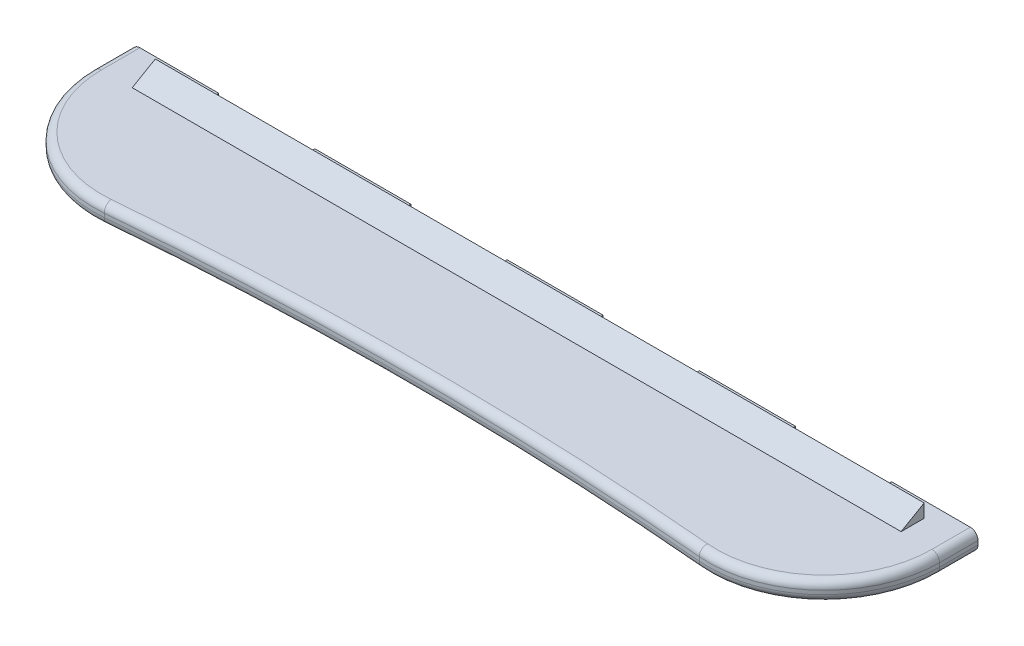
SolidWorks part; units mm, degrees
ref_plane "Спереди" through (0, 0, 0) normal (0, 0, 1) x (1, 0, 0)
ref_plane "Сверху" through (0, 0, 0) normal (0, 1, 0) x (1, 0, 0)
ref_plane "Справа" through (0, 0, 0) normal (1, 0, 0) x (0, 0, -1)
sketch "Эскиз1" plane through (0, 0, 0) normal (0, 1, 0) x (1, 0, 0)
  line L0 (-110, 16) -> (110, 16) construction
  line L1 (-110, 20) -> (110, 20) construction
  line L2 (-110, 20) -> (-110, -20) construction
  line L3 (-110, -20) -> (110, -20) construction
  line L4 (110, 20) -> (110, -20) construction
  line L5 (-110, 20) -> (110, -20) construction
  line L6 (-110, -20) -> (110, 20) construction
  line L7 (-110, 10) -> (-80, 10) construction
  line L8 (-110, 10) -> (-110, 20)
  line L9 (-80, 10) -> (-77.3853, -19.8858) construction
  line L10 (110, 10) -> (80, 10) construction
  line L11 (110, 10) -> (110, 20)
  line L12 (80, 10) -> (77.3853, -19.8858) construction
  line L13 (110, 20) -> (87.5, 20)
  line L14 (87.5, 20) -> (87.5, 16)
  line L15 (87.5, 16) -> (62.5, 16)
  line L16 (62.5, 16) -> (62.5, 20)
  line L17 (62.5, 20) -> (37.5, 20)
  line L18 (37.5, 20) -> (37.5, 16)
  line L19 (37.5, 16) -> (12.5, 16)
  line L20 (12.5, 16) -> (12.5, 20)
  line L21 (12.5, 20) -> (-12.5, 20)
  line L22 (-12.5, 20) -> (-12.5, 16)
  line L23 (-12.5, 16) -> (-37.5, 16)
  line L24 (-37.5, 16) -> (-37.5, 20)
  line L25 (-37.5, 20) -> (-62.5, 20)
  line L26 (-62.5, 20) -> (-62.5, 16)
  line L27 (-62.5, 16) -> (-87.5, 16)
  line L28 (-87.5, 16) -> (-87.5, 20)
  line L29 (-87.5, 20) -> (-110, 20)
  arc A1 (-110, 10) -> (-77.3853, -19.8858) centre (-80, 10) ccw
  arc A2 (77.3853, -19.8858) -> (110, 10) centre (80, 10) ccw
  arc A3 (-77.3853, -19.8858) -> (77.3853, -19.8858) centre (0, -904.4042) cw
  point P0 (0, 0)
  dimension "D1" = 220
  dimension "D2" = 4
  dimension "D3" = 40
  dimension "D4" = 30
  dimension "D5" = 30
  dimension "D6" = 30
  dimension "D7" = 30
  dimension "D8" = 25
  dimension "D9" = 25
  dimension "D10" = 25
  dimension "D11" = 25
  dimension "D12" = 12.5
  dimension "D13" = 25
  dimension "D14" = 25
  dimension "D15" = 25
  dimension "D16" = 95
  dimension "D17" = 85
extrude "Бобышка-Вытянуть1" add sketch "Эскиз1" along normal blind 5
sketch "Эскиз2" plane through (110, 0, 0) normal (1, 0, 0) x (0, 0, -1)
  line L0 (10, 5) -> (16, 8.4641)
  line L1 (16, 8.4641) -> (16, 5)
  line L2 (10, 5) -> (20, 5) construction
  line L3 (16, 5) -> (10, 5)
  dimension "D1" = 6
  dimension "D2" = 30
extrude "Бобышка-Вытянуть2" add sketch "Эскиз2" against normal blind 200 from offset 10
sketch "Эскиз3" plane through (0, 0, 0) normal (0, -1, 0) x (1, 0, 0)
  line L0 (73, 13.75) -> (67, 13.75)
  line L1 (90, 12) -> (-90, 12) construction
  line L3 (93, 10.25) -> (87, 10.25)
  line L5 (93, 13.75) -> (87, 13.75)
  line L6 (87, 10.25) -> (87, 13.75) construction
  line L7 (93, 10.25) -> (87, 13.75) construction
  line L8 (93, 13.75) -> (87, 10.25) construction
  line L44 (73, 10.25) -> (67, 10.25)
  line L45 (53, 13.75) -> (47, 13.75)
  line L46 (53, 10.25) -> (47, 10.25)
  line L47 (33, 13.75) -> (27, 13.75)
  line L48 (33, 10.25) -> (27, 10.25)
  line L49 (13, 13.75) -> (7, 13.75)
  line L50 (13, 10.25) -> (7, 10.25)
  line L51 (-7, 13.75) -> (-13, 13.75)
  line L52 (-7, 10.25) -> (-13, 10.25)
  line L53 (-27, 13.75) -> (-33, 13.75)
  line L54 (-27, 10.25) -> (-33, 10.25)
  line L55 (-47, 13.75) -> (-53, 13.75)
  line L56 (-47, 10.25) -> (-53, 10.25)
  line L57 (-67, 13.75) -> (-73, 13.75)
  line L58 (-67, 10.25) -> (-73, 10.25)
  line L59 (-87, 13.75) -> (-93, 13.75)
  line L60 (-87, 10.25) -> (-93, 10.25)
  arc A0 (93, 10.25) -> (93, 13.75) centre (93, 12) ccw
  arc A1 (87, 13.75) -> (87, 10.25) centre (87, 12) ccw
  arc A2 (73, 10.25) -> (73, 13.75) centre (73, 12) ccw
  arc A3 (67, 13.75) -> (67, 10.25) centre (67, 12) ccw
  arc A4 (53, 10.25) -> (53, 13.75) centre (53, 12) ccw
  arc A5 (47, 13.75) -> (47, 10.25) centre (47, 12) ccw
  arc A6 (33, 10.25) -> (33, 13.75) centre (33, 12) ccw
  arc A7 (27, 13.75) -> (27, 10.25) centre (27, 12) ccw
  arc A8 (13, 10.25) -> (13, 13.75) centre (13, 12) ccw
  arc A9 (7, 13.75) -> (7, 10.25) centre (7, 12) ccw
  arc A10 (-7, 10.25) -> (-7, 13.75) centre (-7, 12) ccw
  arc A11 (-13, 13.75) -> (-13, 10.25) centre (-13, 12) ccw
  arc A12 (-27, 10.25) -> (-27, 13.75) centre (-27, 12) ccw
  arc A13 (-33, 13.75) -> (-33, 10.25) centre (-33, 12) ccw
  arc A14 (-47, 10.25) -> (-47, 13.75) centre (-47, 12) ccw
  arc A15 (-53, 13.75) -> (-53, 10.25) centre (-53, 12) ccw
  arc A16 (-67, 10.25) -> (-67, 13.75) centre (-67, 12) ccw
  arc A17 (-73, 13.75) -> (-73, 10.25) centre (-73, 12) ccw
  arc A18 (-87, 10.25) -> (-87, 13.75) centre (-87, 12) ccw
  arc A19 (-93, 13.75) -> (-93, 10.25) centre (-93, 12) ccw
  dimension "D1" = 10
  dimension "D2" = 90
  dimension "D3" = 6
  dimension "D4" = 3.5
  dimension "D5" = 90
extrude "Вырез-Вытянуть1" cut sketch "Эскиз3" against normal blind 4
fillet "Скругление1" radius 2 10 edges at (-110, 5, -15) (110, 5, -15) (100.2677, 5, 12.1183) (0, 5, 16.5071) (-110, 0, -15) (110, 0, -15) (100.2677, 0, 12.1183) (0, 0, 16.5071) (-100.2677, 5, 12.1183) (-100.2677, 0, 12.1183)
